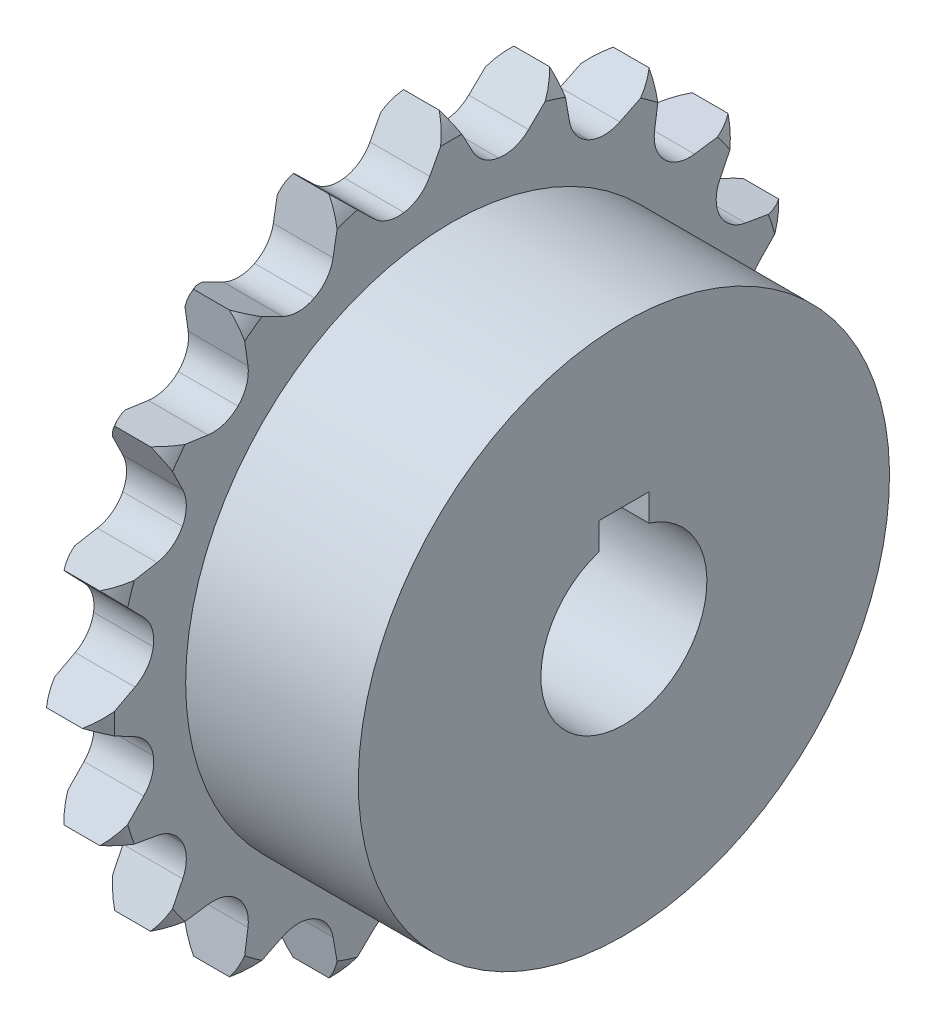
SolidWorks part; units mm, degrees
ref_plane "Plan de face" through (0, 0, 0) normal (0, 0, 1) x (1, 0, 0)
ref_plane "Plan de dessus" through (0, 0, 0) normal (0, 1, 0) x (1, 0, 0)
ref_plane "Plan de droite" through (0, 0, 0) normal (1, 0, 0) x (0, 0, -1)
imported_body "Importée1"
sketch "Esquisse1" plane through (28, 0, 0) normal (1, 0, 0) x (0, 0, -1)
  line L2 (-3, 9.5394) -> (-3, 12.8)
  line L3 (-3, 12.8) -> (3, 12.8)
  line L4 (3, 9.5394) -> (3, 12.8)
  arc A0 (-3, 9.5394) -> (3, 9.5394) centre (0, 0) ccw
  dimension "D1" = 20
  dimension "D2" = 22.8
  dimension "D3" = 3
  dimension "D4" = 6
extrude "Enlèv. mat.-Extru.1" cut sketch "Esquisse1" against normal up to vertex
ref_plane "Plan1" through (3.6, 0, 0) normal (-1, 0, 0) x (0, 0, 1)
sketch "Esquisse2" plane through (3.6, 0, 0) normal (-1, 0, 0) x (0, 0, 1)
  circle A0 centre (0, 0) radius 40.595 construction
  dimension "D1" = 81.19
